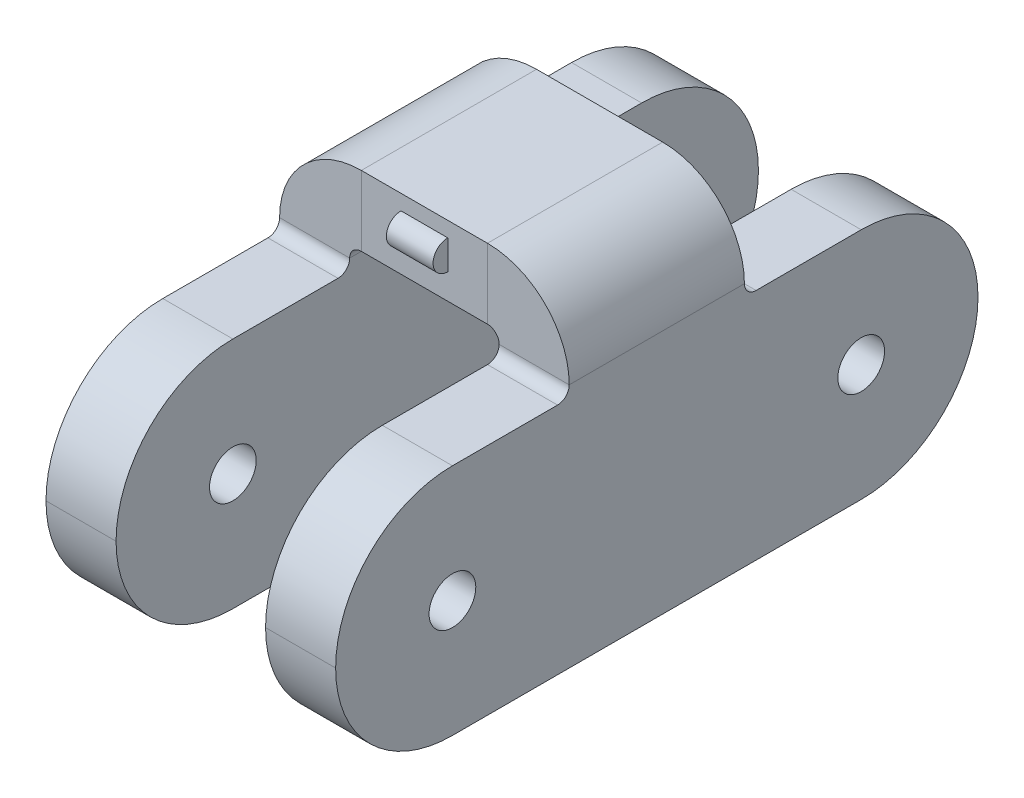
SolidWorks part; units mm, degrees
ref_plane "Frontal" through (0, 0, 0) normal (0, 0, 1) x (1, 0, 0)
ref_plane "Horizontal" through (0, 0, 0) normal (0, 1, 0) x (1, 0, 0)
ref_plane "Vertical" through (0, 0, 0) normal (1, 0, 0) x (0, 0, -1)
sketch "Esquisse1" plane through (0, 0, 0) normal (0, 0, 1) x (1, 0, 0)
  line L0 (0, -28.17) -> (0, 67.8379) construction
  line L1 (3.2, 0) -> (3.2, 11)
  line L2 (-3.2, 0) -> (-3.2, 11)
  line L3 (3.2, 11) -> (-3.2, 11)
  line L4 (-23.7525, 0) -> (40.1598, 0) construction
  dimension "D1" = 6.4
  dimension "D2" = 11
extrude "Base-Extru.-Mince" add sketch "Esquisse1" along normal blind 27.5 thin
sketch "Esquisse4"
  line L5 (0, 0) -> (0, 14) construction
  line L6 (0, 10) -> (10, 10)
  line L7 (13.75, 0) -> (13.75, 20.0097) construction
  line L8 (10, 10) -> (10, 14)
  line L11 (27.5, 10) -> (17.5, 10)
  line L12 (27.5, 0) -> (0, 0) construction
  line L13 (27.5, 14) -> (0, 14) construction
  line L14 (27.5, 14) -> (27.5, 10)
  line L15 (0, 14) -> (0, 10)
  line L16 (10, 14) -> (0, 14)
  line L17 (17.5, 10) -> (17.5, 14)
  line L18 (27.5, 14) -> (17.5, 14)
bend "Pli dans angle2" parameters "D1"=0
flatten bends "Dépliage 1" parameters "D1"=0
sketch "Esquisse-Angle1" plane through (0, 11, 0) normal (0, -1, 0) x (1, 0, 0)
  line L0 (-4.2708, 17.5) -> (-4.2708, 10) construction
  line L1 (4.2708, 10) -> (4.2708, 17.5) construction
bend "Pli dans angle1" bend angle 90 parameters "D1"=0, "D5"=2
sheet metal parameters "Tôlerie 1" parameters "D1"=0.5, "D4"=90, "D5"=1
extrude "Enlèv. mat.-Extru.1" cut sketch "Esquisse4" against normal through all
fillet "Congé2" radius 5
fillet "Congé3" radius 0.5
sketch "Esquisse5" plane through (-6.2, 0, 0) normal (-1, 0, 0) x (0, 0, 1)
  circle A0 centre (5, 5) radius 1
  circle A1 centre (22.5, 5) radius 1
  arc A2 (5, 10) -> (0, 5) centre (5, 5) ccw construction
  arc A3 (22.5, 0) -> (27.5, 5) centre (22.5, 5) ccw construction
  dimension "D1" = 2
  dimension "D2" = 2
extrude "Enlèv. mat.-Extru.2" cut sketch "Esquisse5" against normal through all
process bends "Pliage 1" parameters "D1"=0
sketch "Esquisse-Plate1" plane through (0, 11, 0) normal (0, -1, 0) x (1, 0, 0)
sketch "Esquisse6" plane through (0, 0, 0) normal (1, 0, 0) x (0, 0, -1)
  line L0 (-17.5, 14) -> (-17.5, 10.5) construction
  line L1 (-17.5, 13.35) -> (-17.5, 12.0926)
  arc A0 (-17.5, 13.35) -> (-17.5, 12.0926) centre (-17.5, 12.7213) ccw
extrude "Boss.-Extru.1" add sketch "Esquisse6" along normal mid plane 2
